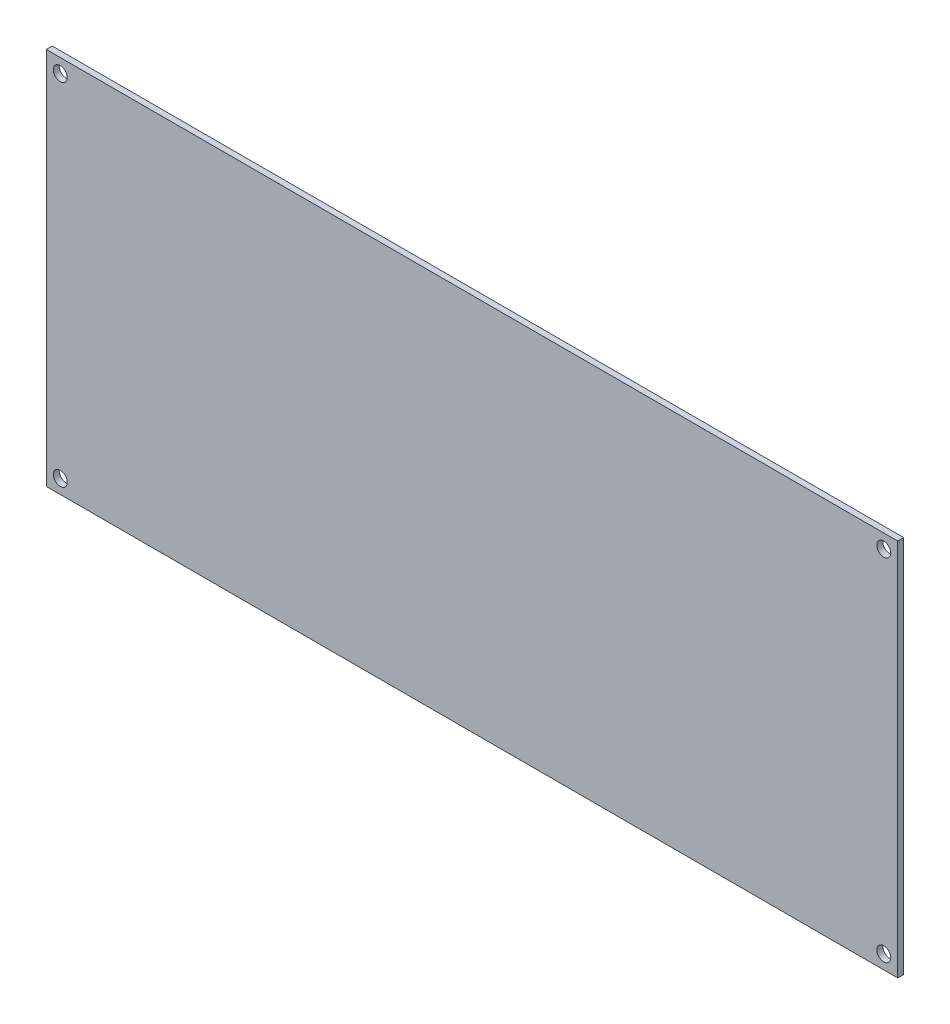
SolidWorks part; units mm, degrees
ref_plane "Front Plane" through (0, 0, 0) normal (0, 0, 1) x (1, 0, 0)
ref_plane "Top Plane" through (0, 0, 0) normal (0, 1, 0) x (1, 0, 0)
ref_plane "Right Plane" through (0, 0, 0) normal (1, 0, 0) x (0, 0, -1)
sketch "Sketch1" plane through (0, 0, 0) normal (0, 0, 1) x (1, 0, 0)
  line L1 (0, 0) -> (228.6, 0)
  line L2 (0, 0) -> (0, 101.6)
  line L3 (0, 101.6) -> (228.6, 101.6)
  line L4 (228.6, 0) -> (228.6, 101.6)
  dimension "D1" = 101.6
  dimension "D2" = 228.6
extrude "Extrude1" add sketch "Sketch1" along normal blind 1.6
sketch "Sketch3" plane through (0, 0, 1.6) normal (0, 0, 1) x (1, 0, 0)
  line L0 (0, 101.6) -> (0, 0) construction
  line L1 (228.6, 101.6) -> (0, 101.6) construction
  line L2 (228.6, 0) -> (228.6, 101.6) construction
  line L3 (0, 0) -> (228.6, 0) construction
  circle A0 centre (3.75, 97.85) radius 1.875
  circle A1 centre (224.85, 97.85) radius 1.875
  circle A2 centre (224.85, 3.75) radius 1.875
  circle A3 centre (3.75, 3.75) radius 1.875
  dimension "D1" = 3.75
  dimension "D2" = 3.75
  dimension "D3" = 3.75
  dimension "D4" = 3.75
  dimension "D5" = 3.75
extrude "Extrude3" cut sketch "Sketch3" against normal through all
sketch "Tracks (Top)"
sketch "Tracks (Bottom)"
